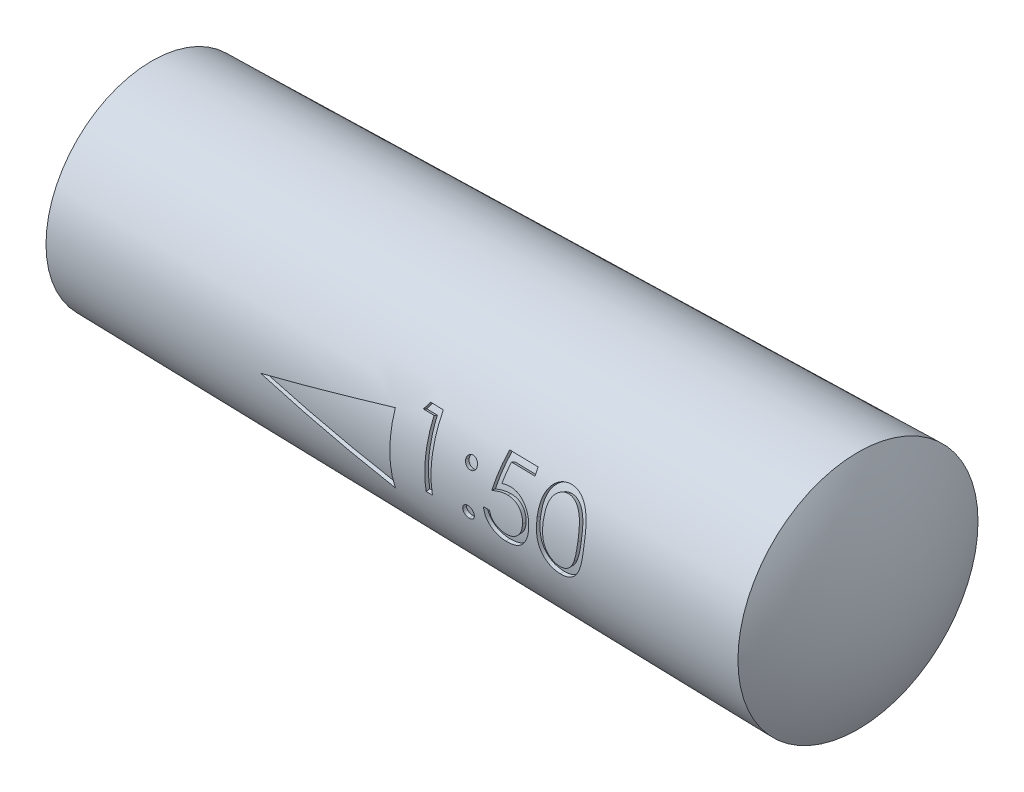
SolidWorks part; units mm, degrees
ref_plane "Front Plane" through (0, 0, 0) normal (0, 0, 1) x (1, 0, 0)
ref_plane "Top Plane" through (0, 0, 0) normal (0, 1, 0) x (1, 0, 0)
ref_plane "Right Plane" through (0, 0, 0) normal (1, 0, 0) x (0, 0, -1)
sketch "Sketch1" plane through (0, 0, 0) normal (1, 0, 0) x (0, 0, -1)
  circle A0 centre (0, 0) radius 1.5
  dimension "D1" = 3
extrude "Extrude1" add sketch "Sketch1" along normal mid plane 10
draft "Draft1" type of draft neutral plane draft angle 1.146 faces to draft 1 parameters "D1"=1.146
sketch "Sketch2" plane through (0, 0, 0) normal (0, 0, 1) x (1, 0, 0)
  line L0 (-5, 0) -> (-5, 1.5)
  line L1 (-5, 1.5) -> (-5, -1.5) construction
  line L2 (-5, 0) -> (-5.45, 0)
  line L3 (-5.45, 0) -> (-5.45, -1.6) construction
  line L4 (5, 0) -> (5, 1.7)
  line L5 (5, -1.7) -> (5, 1.7) construction
  line L6 (5, 0) -> (5.45, 0)
  line L7 (5.45, 0) -> (5.45, -1.6) construction
  line L8 (-5, -1.5) -> (5, -1.7) construction
  arc A0 (-5.45, 0) -> (-5, 1.5) centre (-2.725, 0) cw
  arc A1 (5.45, 0) -> (5, 1.7) centre (2.0139, 0) ccw
  point P14 (0, -1.6)
revolve "Revolve1" add sketch "Sketch2" angle 360 about L2
sketch "Sketch5" plane through (0, 0, 0) normal (0, 0, 1) x (1, 0, 0)
  line L0 (0, 1.6) -> (0, -1.6) construction
  line L1 (5, 1.7) -> (-5, 1.5) construction
  line L2 (-5, -1.5) -> (5, -1.7) construction
ref_plane "Plane2" through (0, 0, 0) normal (-0.02, 0, 0.9998) x (0.9998, 0, 0.02)
sketch "Sketch6" plane through (0, 0, 0) normal (-0.02, 0, 0.9998) x (0.9998, 0, 0.02)
  line L0 (0, 0) -> (0, 0.5)
  line L1 (0, 1.6) -> (0, -1.6) construction
  line L2 (0, 0.5) -> (-1.866, 0)
  line L3 (-1.866, 0) -> (0, -0.5)
  line L4 (0, -0.5) -> (0, 0)
  line L5 (0, -0.25) -> (3, -0.25) construction
  text T0 "1:50" font "Century Gothic" height 1
  dimension "D1" = 1
  dimension "D2" = 30
  dimension "D3" = 3
wrap "Wrap2" sketch "Sketch6" wrap type deboss source sketch "Sketch6" thickness 0.05 parameters "D1"=0.05
equation "\"D2@Sketch2\" = \"D1@Sketch2\""
